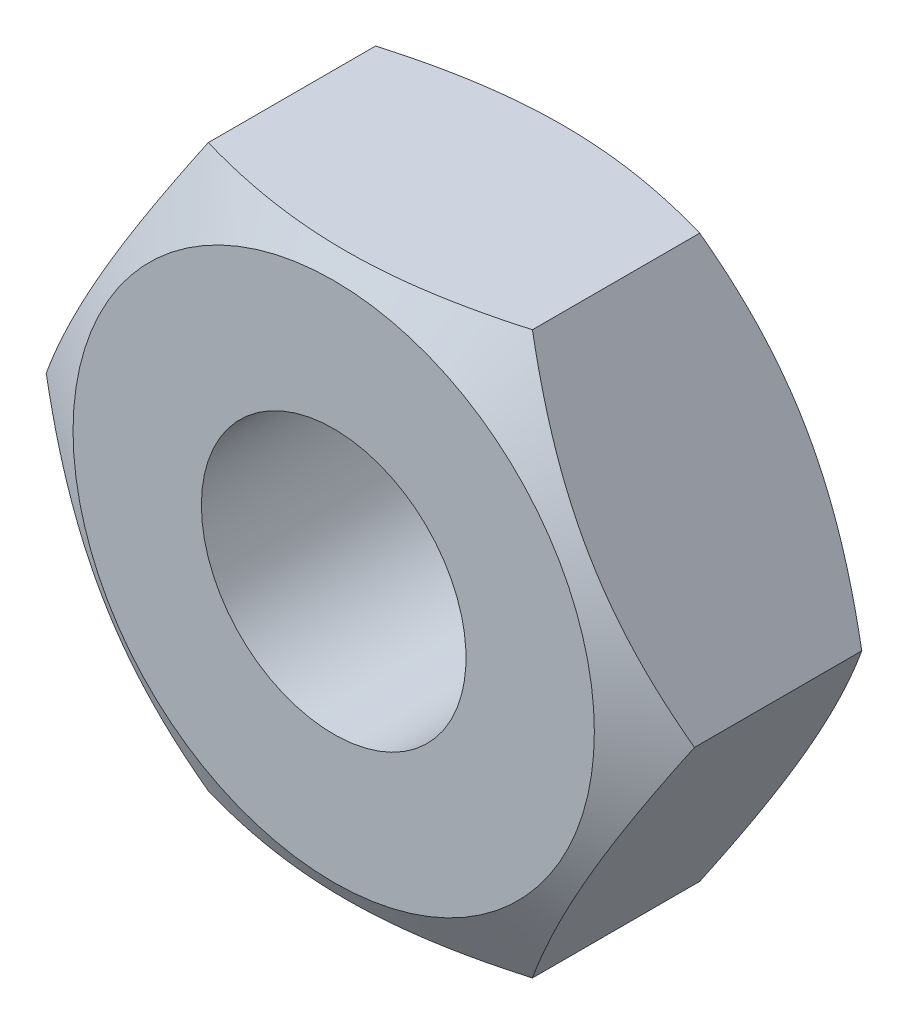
SolidWorks part; units mm, degrees
extrude "Base-Extrusion" add sketch "Esquisse1" along normal blind 3
sketch "Esquisse1" plane through (0, 0, 0) normal (0, 0, 1) x (1, 0, 0)
  line L0 (0, 0) -> (0, 60.5083) construction
  line L1 (0, 0) -> (52.6683, 0) construction
  line L2 (-4.0415, 0) -> (-2.0207, 3.5)
  line L3 (-2.0207, 3.5) -> (2.0207, 3.5)
  line L4 (2.0207, 3.5) -> (4.0415, 0)
  line L5 (4.0415, 0) -> (2.0207, -3.5)
  line L6 (2.0207, -3.5) -> (-2.0207, -3.5)
  line L7 (-2.0207, -3.5) -> (-4.0415, 0)
  dimension "D1" = 120
  dimension "D2" = 7
ref_plane "Plane1" through (0, 0, 0) normal (0, 0, 1) x (1, 0, 0)
ref_plane "Plane2" through (0, 0, 0) normal (0, 1, 0) x (1, 0, 0)
ref_plane "Plane3" through (0, 0, 0) normal (1, 0, 0) x (0, 0, -1)
sketch "Esquisse3" plane through (0, 0, 0) normal (0, 1, 0) x (1, 0, 0)
  line L2 (-2.0207, 0) -> (2.0207, 0) construction
  line L3 (-4.0415, -3) -> (-4.0415, 0) construction
  line L4 (-4.0415, 0) -> (-2.0207, 0) construction
  line L5 (-3.25, 0) -> (-4.0415, 0)
  line L6 (-3.25, 0) -> (-4.0415, -0.4569)
  line L7 (0, 2.8527) -> (0, -4.5118) construction
  line L8 (-4.0415, 0) -> (-4.0415, -0.4569)
revolve "Enlever de la matière-Révolution1" cut sketch "Esquisse3" angle 360 about L7
ref_plane "Plan4" through (0, 0, 1.5) normal (0, 0, -1) x (-1, 0, 0)
mirror "Symétrie1" about plane through (0, 0, 1.5) normal (0, 0, -1)
hole_wizard "Perçage1" positions "Esquisse5" profile "Esquisse4" tap size "M4x0.7" standard "ISO"
sketch "Esquisse5" plane through (0, 0, 0) normal (0, 0, -1) x (-1, 0, 0)
  circle A1 centre (0, 0) radius 3.25 construction
  point P0 (0, 0)
sketch "Esquisse4" plane through (0, 0, 0) normal (1, 0, 0) x (0, 1, 0)
  line L0 (0, 0) -> (0, 3)
  line L1 (0, 3) -> (1.65, 3)
  line L2 (1.65, 3) -> (1.65, 0)
  line L5 (1.65, 0) -> (0, 0)
  line L11 (0, -6.35) -> (0, 107.95) construction
  dimension "Diamètre du perçage jusqu'au prochain" = 3.3
  dimension "Profondeur du perçage jusqu'au prochain" = 3
equation "\"D2@Esquisse3\" =( \"D2@Esquisse1\"-0.5)/2"
equation "\"D1@Plan4\" = \"D1@Base-Extrusion\"/2"
